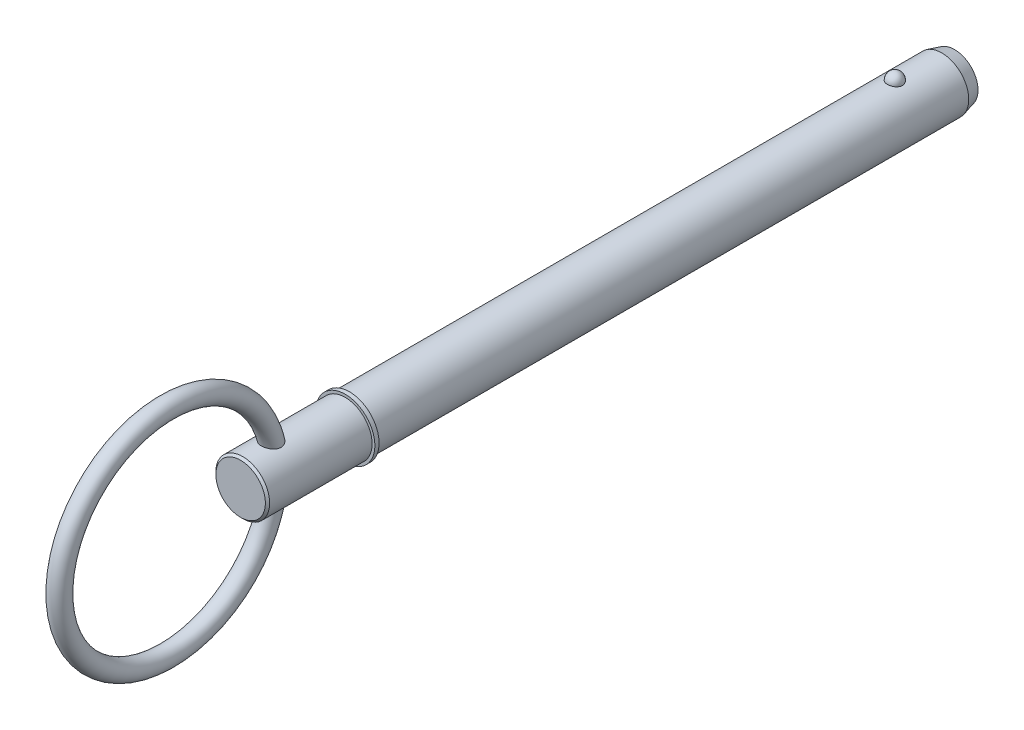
SolidWorks part; units mm, degrees
ref_plane "Front Plane" through (0, 0, 0) normal (0, 0, 1) x (1, 0, 0)
ref_plane "Top Plane" through (0, 0, 0) normal (0, 1, 0) x (1, 0, 0)
ref_plane "Right Plane" through (0, 0, 0) normal (1, 0, 0) x (0, 0, -1)
sketch "Sketch2" plane through (0, 0, 0) normal (0, 0, 1) x (1, 0, 0)
  circle A0 centre (0, 0) radius 6.35
  point P3 (0, 6.35)
  dimension "D1" = 12.7
extrude "Boss-Extrude1" add sketch "Sketch2" along normal blind 127
sketch "Sketch3" plane through (0, 0, 0) normal (0, 0, -1) x (-1, 0, 0)
  circle A0 centre (0, 0) radius 6.35
  dimension "D1" = 12.7
extrude "Boss-Extrude2" add sketch "Sketch3" along normal blind 15.88
chamfer "Chamfer1" distance 3 angle 15 1 edges at (-6.35, 0, -15.88)
sketch "Sketch18" plane through (0, 0, 0) normal (1, 0, 0) x (0, 0, -1)
  line L0 (12.88, 6.35) -> (-127, 6.35) construction
  line L1 (1.78, 8.13) -> (1.78, 4.57)
  line L2 (-127, -6.35) -> (12.88, -6.35) construction
  arc A0 (1.78, 8.13) -> (1.78, 4.57) centre (1.78, 6.35) ccw
  point P4 (0, 6.35)
  dimension "D1" = 14.48
revolve "Revolve1" add sketch "Sketch18" angle 360 about L1
sketch "Sketch19" plane through (0, 0, 0) normal (1, 0, 0) x (0, 0, -1)
  line L0 (-33.7288, 0) -> (-46.4542, 0) construction
sketch "Sketch20" plane through (0, 0, 0) normal (1, 0, 0) x (0, 0, -1)
  line L0 (-127, 0) -> (-127, 7)
  line L1 (-127, 6.35) -> (-127, -6.35) construction
  line L2 (-127, 7) -> (-128, 7)
  line L3 (-128, 7) -> (-128, 0)
  line L4 (-33.7288, 0) -> (-46.4542, 0) construction
  line L5 (-128, 0) -> (-127, 0)
  dimension "D1" = 7
  dimension "D2" = 1
revolve "Revolve2" add sketch "Sketch20" angle 360 about L0
sketch "Sketch21" plane through (0, 0, 127) normal (0, 0, -1) x (-1, 0, 0)
  circle A0 centre (0, 0) radius 6.35
  dimension "D1" = 12.7
extrude "Boss-Extrude3" add sketch "Sketch21" against normal blind 25.7
chamfer "Chamfer2" distance 0.5 angle 45 1 edges at (-6.35, 0, 152.7)
sketch "Sketch23" plane through (0, 0, 0) normal (1, 0, 0) x (0, 0, -1)
  line L0 (-152.7, 5.85) -> (-152.7, -5.85) construction
  circle A0 centre (-170.1, 0) radius 25.4
  point P2 (-144.7, 0)
  dimension "D1" = 50.8
  dimension "D2" = 8
sketch "Sketch24" plane through (0, 0, 0) normal (0, 1, 0) x (1, 0, 0)
  circle A0 centre (0, -144.7) radius 2.25
  dimension "D1" = 4.5
sweep "Sweep1" add profiles "Sketch24" path "Sketch23"
